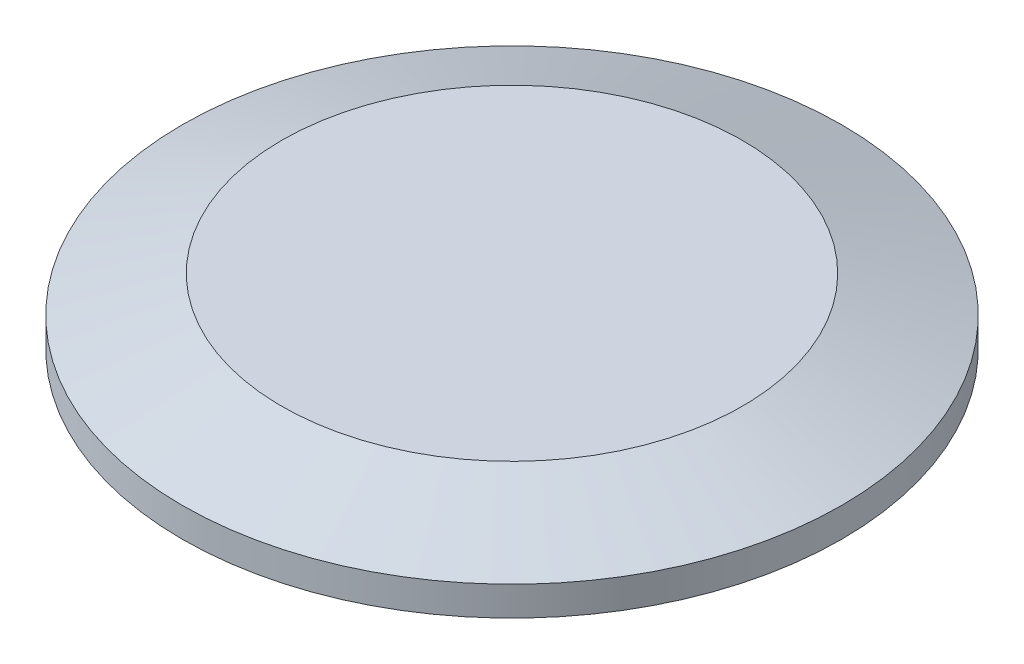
SolidWorks part; units mm, degrees
ref_plane "Front Plane" through (0, 0, 0) normal (0, 0, 1) x (1, 0, 0)
ref_plane "Top Plane" through (0, 0, 0) normal (0, 1, 0) x (1, 0, 0)
ref_plane "Right Plane" through (0, 0, 0) normal (1, 0, 0) x (0, 0, -1)
sketch "Sketch1" plane through (0, 0, 0) normal (0, 0, 1) x (1, 0, 0)
  line L0 (0, 0) -> (-26.3506, 0)
  line L1 (-31.9532, 0) -> (-31.9532, 2.8448)
  line L2 (-31.9532, 2.8448) -> (-22.3227, 6.35)
  line L3 (-22.3227, 6.35) -> (0, 6.35)
  line L4 (0, 6.35) -> (0, 0) construction
  line L5 (-29.9866, 0) -> (-31.9532, 0)
  line L6 (0, 0) -> (0, 6.35)
  arc A0 (-27.0731, 0.4745) -> (-29.2641, 0.4745) centre (-28.1686, 0) ccw
  arc A1 (-26.3506, 0) -> (-27.0731, 0.4745) centre (-26.3506, 0.7874) cw
  arc A2 (-29.9866, 0) -> (-29.2641, 0.4745) centre (-29.9866, 0.7874) ccw
  point P13 (-29.3624, 0)
  dimension "D1" = 2.3876
  dimension "D2" = 0.7874
  dimension "D3" = 31.9532
  dimension "D4" = 28.1686
  dimension "D5" = 2.8448
  dimension "D6" = 20
  dimension "D7" = 6.35
revolve "Revolve1" add sketch "Sketch1" angle 360 about L4
